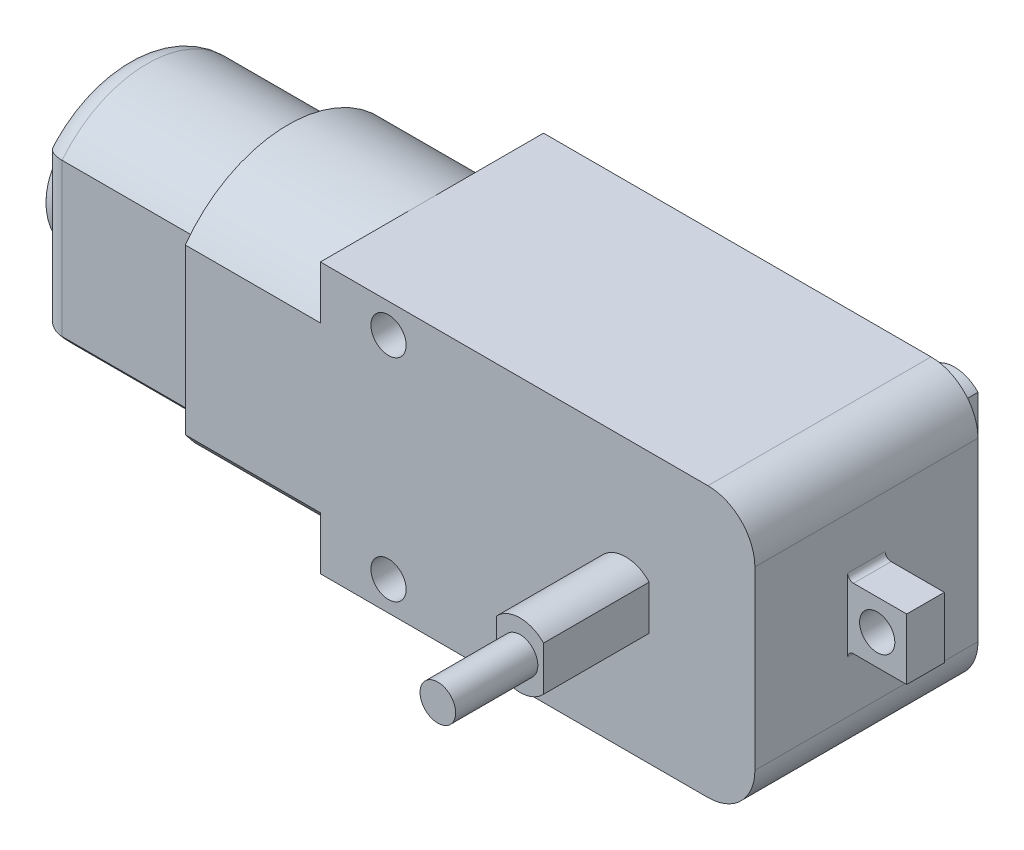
SolidWorks part; units mm, degrees
ref_plane "Plano frontal" through (0, 0, 0) normal (0, 0, 1) x (1, 0, 0)
ref_plane "Plano superior" through (0, 0, 0) normal (0, 1, 0) x (1, 0, 0)
ref_plane "Plano direito" through (0, 0, 0) normal (1, 0, 0) x (0, 0, -1)
sketch "Esboço1" plane through (0, 0, 0) normal (1, 0, 0) x (0, 0, -1)
  line L1 (-9.5, -11.5) -> (9.5, -11.5)
  line L2 (-9.5, -11.5) -> (-9.5, 11.5)
  line L3 (-9.5, 11.5) -> (9.5, 11.5)
  line L4 (9.5, -11.5) -> (9.5, 11.5)
  line L5 (-9.5, -11.5) -> (9.5, 11.5) construction
  line L6 (-9.5, 11.5) -> (9.5, -11.5) construction
  point P0 (0, 0)
  dimension "D1" = 19
  dimension "D2" = 23
extrude "Ressalto-extrusão1" add sketch "Esboço1" along normal blind 37
fillet "Filete3" radius 4 2 edges at (37, -11.5, 0) (37, 11.5, 0)
sketch "Esboço2" plane through (37, 0, 0) normal (1, 0, 0) x (0, 0, -1)
  line L0 (0, 0) -> (0, 7.5) construction
  line L1 (9.5, 7.5) -> (-9.5, 7.5) construction
  line L2 (0, 7.5) -> (0, -7.5) construction
  line L3 (-9.5, -7.5) -> (9.5, -7.5) construction
  line L5 (-1.6, -2.6) -> (1.6, -2.6)
  line L6 (-1.6, -2.6) -> (-1.6, 2.6)
  line L7 (-1.6, 2.6) -> (1.6, 2.6)
  line L8 (1.6, -2.6) -> (1.6, 2.6)
  line L9 (-1.6, -2.6) -> (1.6, 2.6) construction
  line L10 (-1.6, 2.6) -> (1.6, -2.6) construction
  dimension "D1" = 3.2
  dimension "D2" = 5.2
extrude "Ressalto-extrusão2" add sketch "Esboço2" along normal blind 5.0308
sketch "Esboço4" plane through (0, 0, -1.6) normal (0, 0, -1) x (-1, 0, 0)
  line L0 (-37, 2.6) -> (-42.0308, -2.6)
  line L1 (-42.0308, 2.6) -> (-37, -2.6) construction
  circle A0 centre (-39.5154, 0) radius 1.5
  dimension "D1" = 3
extrude "Corte-extrusão1" cut sketch "Esboço4" against normal through all contours A0
fillet "Filete4" radius 0.5 1 edges at (37, 2.6, 0)
fillet "Filete5" radius 0.5 1 edges at (37, -2.6, 0)
sketch "Esboço6" plane through (0, 0, -9.5) normal (0, 0, -1) x (-1, 0, 0)
  line L0 (-33, -11.5) -> (0, -11.5) construction
  line L3 (-28, -1.8875) -> (-28, 1.8875)
  line L5 (-24, -1.8875) -> (-24, 1.8875)
  arc A0 (-28, -1.8875) -> (-24, -1.8875) centre (-26, 0) ccw
  arc A1 (-24, 1.8875) -> (-28, 1.8875) centre (-26, 0) ccw
  point P2 (-16.5, -11.5)
  dimension "D1" = 5.5
  dimension "D2" = 26
  dimension "D3" = 11.5
extrude "Ressalto-extrusão6" add sketch "Esboço6" along normal blind 9 and the other way blind 28 contours A1 L3 A0 L5
sketch "Esboço10" plane through (0, 0, -9.5) normal (0, 0, -1) x (-1, 0, 0)
  line L0 (-33, 11.5) -> (0, 11.5) construction
  circle A0 centre (-14, 0) radius 2
  point P2 (-16.5, 11.5)
  dimension "D1" = 4
  dimension "D2" = 14
  dimension "D3" = 11.5
extrude "Ressalto-extrusão7" add sketch "Esboço10" along normal blind 2
sketch "Esboço11" plane through (0, 0, 0) normal (-1, 0, 0) x (0, 0, 1)
  line L0 (9.5, 11.5) -> (9.5, -11.5) construction
  line L1 (-9.5, 11.5) -> (9.5, 11.5)
  line L2 (-9.5, 11.5) -> (-9.5, 7)
  line L3 (9.5, -7) -> (9.5, 7)
  line L4 (9.5, 11.5) -> (9.5, 7)
  line L6 (-9.5, -11.5) -> (9.5, -11.5)
  line L7 (-9.5, -11.5) -> (-9.5, -7)
  line L9 (9.5, -11.5) -> (9.5, -7)
  line L10 (-9.5, 11.5) -> (-8, 11.5)
  line L11 (-9.5, 11.5) -> (-9.5, -11.5)
  line L12 (-9.5, -11.5) -> (-8, -11.5)
  line L13 (-8, 7) -> (-8, -7)
  arc A0 (-8, 7) -> (9.5, 7) centre (0.75, 0.7431) cw
  arc A1 (-8, -7) -> (9.5, -7) centre (0.75, -0.7431) ccw
  dimension "D1" = 4.5
  dimension "D2" = 4.5
  dimension "D3" = 1.5
extrude "Ressalto-extrusão8" add sketch "Esboço11" along normal blind 11.5 contours A0 L3 A1 L13
sketch "Esboço12" plane through (-11.5, 0, 0) normal (-1, 0, 0) x (0, 0, 1)
  line L4 (-6.5, 6.4988) -> (-6.5, -6.4988)
  line L5 (8, -6.4988) -> (8, 6.4988)
  line L6 (-6.5, 6.4988) -> (-6.5, -6.4988)
  line L7 (8, -6.4988) -> (8, 6.4988)
  arc A4 (-6.5, -6.4988) -> (8, -6.4988) centre (0.75, -0.7431) ccw
  arc A5 (8, 6.4988) -> (-6.5, 6.4988) centre (0.75, 0.7431) ccw
  arc A6 (-6.5, -6.4988) -> (8, -6.4988) centre (0.75, -0.7431) ccw
  arc A7 (8, 6.4988) -> (-6.5, 6.4988) centre (0.75, 0.7431) ccw
  dimension "D1" = 1.5
extrude "Ressalto-extrusão9" add sketch "Esboço12" along normal blind 14
fillet "Filete6" radius 2 4 edges at (-25.5, 0, 8) (-25.5, -10, 0.75) (-25.5, 0, -6.5) (-25.5, 10, 0.75)
sketch "Esboço13" plane through (-25.5, 0, 0) normal (-1, 0, 0) x (0, 0, 1)
  line L0 (-4.5, 5.7531) -> (6, -5.7531) construction
  line L1 (6, -5.7531) -> (-4.5, -5.7531) construction
  line L2 (-4.5, -5.7531) -> (6, 5.7531) construction
  circle A0 centre (0.75, 0) radius 5
  circle A1 centre (0.75, 0) radius 1
  dimension "D1" = 10
  dimension "D2" = 2
extrude "Ressalto-extrusão12" add sketch "Esboço13" along normal blind 2.5
fillet "Filete7" radius 1.5 1 edges at (-28, 0, 5.75)
sketch "Esboço14" plane through (0, 0, -9.5) normal (0, 0, -1) x (-1, 0, 0)
  line L0 (-33, 11.5) -> (0, 11.5) construction
  line L1 (-33, -11.5) -> (0, -11.5) construction
  circle A0 centre (-5.8, 9) radius 1.5
  circle A1 centre (-5.8, -9) radius 1.5
  point P2 (-16.5, 11.5)
  point P8 (-16.5, -11.5)
  dimension "D1" = 3
  dimension "D4" = 3
  dimension "D2" = 5.8
  dimension "D3" = 2.5
  dimension "D5" = 5.8
  dimension "D6" = 2.5
extrude "Corte-extrusão2" cut sketch "Esboço14" against normal through all
sketch "Esboço16" plane through (0, 0, 18.5) normal (0, 0, 1) x (1, 0, 0)
  circle A0 centre (26, 0) radius 1.5168
extrude "Ressalto-extrusão14" add sketch "Esboço16" along normal blind 7
